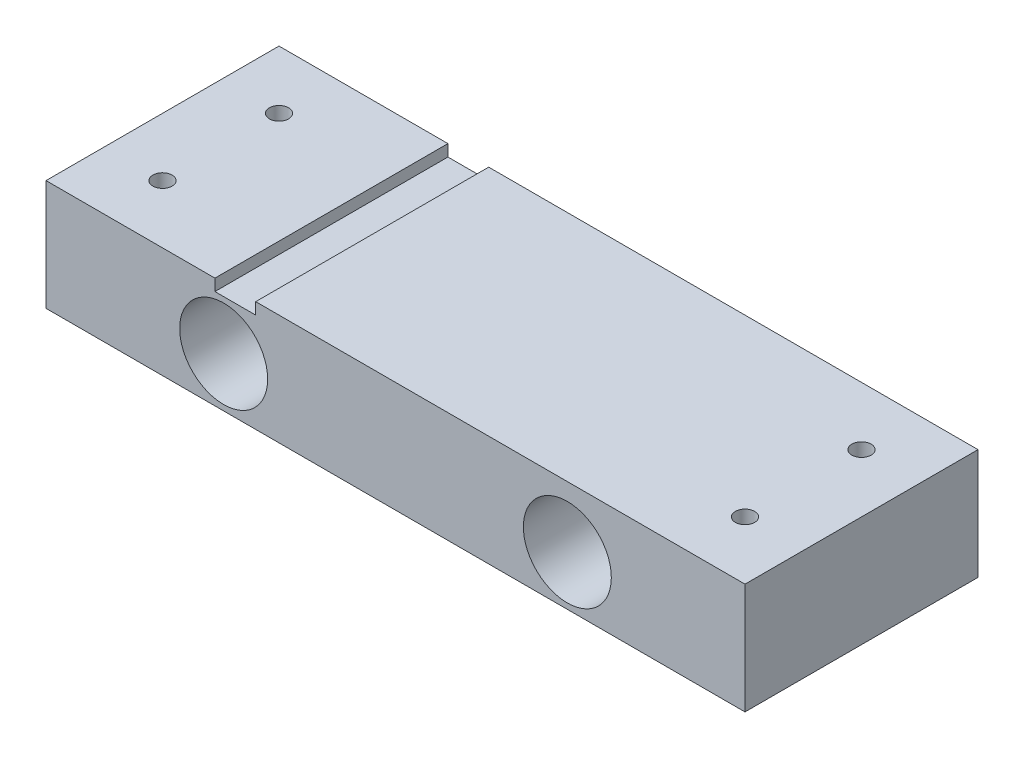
SolidWorks part; units mm, degrees
other "Marca1"
sketch "Croquis4" plane through (38.3855, 11, 40) normal (0.0769, 0.0101, 0.997) x (0.997, -0.0023, -0.0769)
ref_plane "Alzado" through (0, 0, 0) normal (0, 0, 1) x (1, 0, 0)
ref_plane "Planta" through (0, 0, 0) normal (0, 1, 0) x (1, 0, 0)
ref_plane "Vista lateral" through (0, 0, 0) normal (1, 0, 0) x (0, 0, -1)
sketch "Croquis1" plane through (0, 0, 0) normal (0, 0, 1) x (1, 0, 0)
  line L0 (0, 0) -> (0, 11) construction
  line L1 (-60, -8) -> (60, -8)
  line L2 (-60, -8) -> (-60, 11)
  line L3 (-60, 11) -> (-31, 11)
  line L4 (60, -8) -> (60, 11)
  line L5 (-24, 11) -> (60, 11)
  line L7 (-31, 11) -> (-31, 9)
  line L8 (-31, 9) -> (-24, 9)
  line L9 (-24, 11) -> (-24, 9)
  circle A0 centre (-29.5, 0.5) radius 4.1 construction
  circle A1 centre (29.5, 0.5) radius 4.1 construction
  circle A2 centre (-29.5, 0.5) radius 7.55
  circle A3 centre (29.5, 0.5) radius 7.55
  point P0 (0, 0)
  point P18 (-41.4269, 11)
  point P19 (0, 0)
  dimension "D1" = 59
  dimension "D5" = 8.2
  dimension "D6" = 8.2
  dimension "D7" = 15.1
  dimension "D8" = 15.1
  dimension "D2" = 8
  dimension "D3" = 8.5
  dimension "D4" = 19
  dimension "D9" = 120
  dimension "D10" = 7
  dimension "D11" = 2
  dimension "D12" = 24
extrude "Saliente-Extruir1" add sketch "Croquis1" along normal blind 40
sketch "Croquis2" plane through (0, 11, 0) normal (0, 1, 0) x (1, 0, 0)
  line L0 (-50, 0) -> (-50, -40) construction
  line L1 (-31, 0) -> (-60, 0) construction
  line L2 (-31, -40) -> (-60, -40) construction
  line L3 (50, 0) -> (50, -40) construction
  line L4 (60, 0) -> (-24, 0) construction
  line L5 (60, -40) -> (-24, -40) construction
  line L6 (-60, -40) -> (-60, 0) construction
  line L9 (60, -40) -> (60, 0) construction
  circle A0 centre (-50, -10) radius 1.65
  circle A1 centre (50, -10) radius 1.65
  circle A2 centre (50, -30) radius 1.65
  circle A3 centre (-50, -30) radius 1.65
  dimension "D1" = 3.3
  dimension "D2" = 3.3
  dimension "D3" = 3.3
  dimension "D4" = 3.3
  dimension "D5" = 10
  dimension "D6" = 10
  dimension "D7" = 10
  dimension "D8" = 10
  dimension "D9" = 10
  dimension "D10" = 10
extrude "Cortar-Extruir1" cut sketch "Croquis2" against normal blind 5
